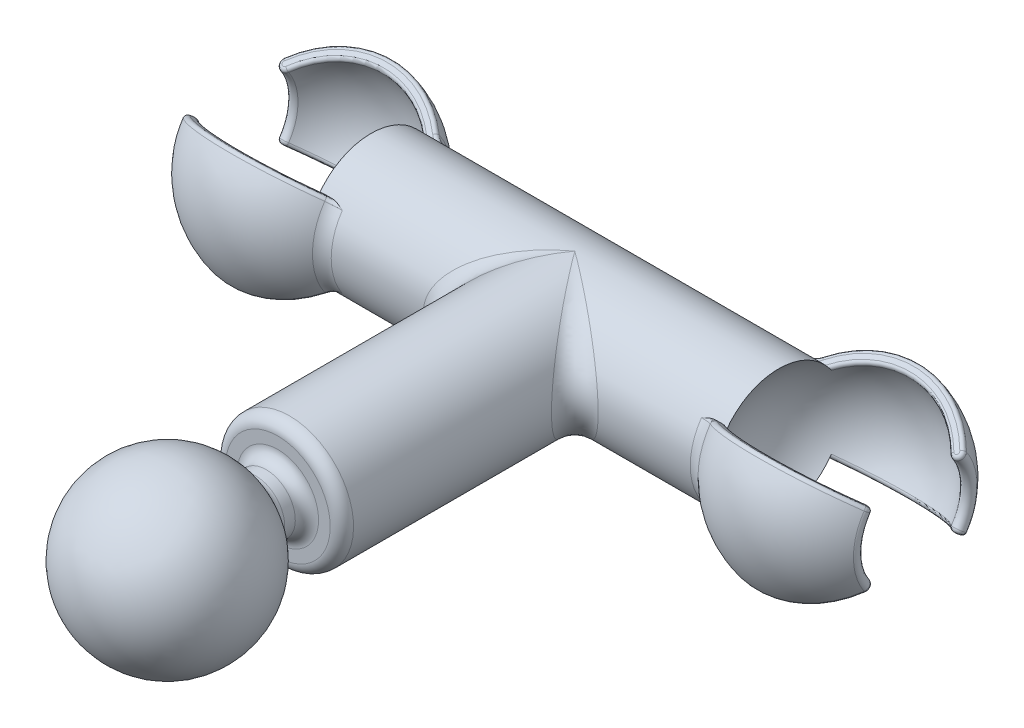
SolidWorks part; units mm, degrees
ref_plane "Front Plane" through (0, 0, 0) normal (0, 0, 1) x (1, 0, 0)
ref_plane "Top Plane" through (0, 0, 0) normal (0, 1, 0) x (1, 0, 0)
ref_plane "Right Plane" through (0, 0, 0) normal (1, 0, 0) x (0, 0, -1)
sketch "Sketch1" plane through (0, 0, 0) normal (0, 0, 1) x (1, 0, 0)
  line L0 (0, 6.985) -> (0, 0)
  line L2 (0, 6.985) -> (22.225, 6.985)
  line L3 (28.7008, 0) -> (-15.6104, 0) construction
  line L4 (0, 0) -> (19.1758, 0)
  line L5 (0, 0) -> (0, 8.7802) construction
  arc A1 (22.225, 6.985) -> (19.1758, 0) centre (28.7008, 0) ccw
  dimension "D1" = 22.225
  dimension "D2" = 9.525
  dimension "D5" = 6.985
revolve "Revolve1" add sketch "Sketch1" angle 360 about L3
sketch "Sketch2" plane through (0, 0, 0) normal (0, 1, 0) x (1, 0, 0)
  line L0 (0, 0) -> (75.9783, 0) construction
  line L2 (0, -6.985) -> (22.225, -6.985) construction
  line L3 (20.4702, -6.985) -> (22.225, -6.985)
  arc A0 (22.225, -6.985) -> (36.1362, -5.9531) centre (28.7008, 0) ccw
  arc A1 (20.4702, -6.985) -> (37.1276, -6.7469) centre (28.7008, 0) ccw
  arc A2 (36.1362, -5.9531) -> (37.1276, -6.7469) centre (36.6319, -6.35) cw
  arc A3 (22.225, 6.985) -> (22.225, -6.985) centre (28.7008, 0) ccw construction
  dimension "D1" = 10.795
  dimension "D3" = 6.35
revolve "Revolve2" add sketch "Sketch2" angle 75 mid plane about L0
mirror "Mirror1" about plane through (0, 0, 0) normal (0, 0, 1) of "Revolve2"
fillet "Fillet2" radius 2.032 2 edges at (20.4702, 0, 6.985) (20.4702, 0, -6.985)
fillet "Fillet3" radius 0.381 16 edges at (37.0288, 3.5639, 4.6445) (20.361, -4.3477, -5.6661) (29.2642, -6.5626, -8.5526) (37.0288, -3.5639, -4.6445) (29.4053, -5.7826, -7.536) (37.0288, -3.5639, 4.6445) (29.4053, -5.7826, 7.536) (20.361, -4.3477, 5.6661) (29.2642, -6.5626, 8.5526) (20.361, 4.3477, 5.6661) (20.361, 4.3477, -5.6661) (37.0288, 3.5639, -4.6445) (29.2642, 6.5626, -8.5526) (29.4053, 5.7826, -7.536) (29.4053, 5.7826, 7.536) (29.2642, 6.5626, 8.5526)
mirror "Mirror2" about plane through (0, 0, 0) normal (1, 0, 0) of "Revolve1", "Revolve2", "Mirror1", "Fillet2", "Fillet3"
sketch "Sketch3" plane through (0, 0, 0) normal (1, 0, 0) x (0, 0, -1)
  line L0 (0, 0) -> (-53.7972, 0)
  line L1 (0, 0) -> (0, 6.985)
  line L2 (0, 6.985) -> (-31.115, 6.985)
  line L3 (-32.385, 5.715) -> (-32.385, 4.445)
  line L4 (-33.655, 3.175) -> (-34.8081, 3.175)
  line L5 (0, 0) -> (-71.7758, 0) construction
  arc A0 (-35.9614, 3.9133) -> (-53.7972, 0) centre (-44.45, 0) ccw
  arc A1 (-31.115, 6.985) -> (-32.385, 5.715) centre (-31.115, 5.715) ccw
  arc A2 (-32.385, 4.445) -> (-33.655, 3.175) centre (-33.655, 4.445) cw
  arc A3 (-34.8081, 3.175) -> (-35.9614, 3.9133) centre (-34.8081, 4.445) cw
  dimension "D5" = 9.3472
  dimension "D6" = 1.27
  dimension "D1" = 44.45
  dimension "D2" = 12.065
  dimension "D3" = 3.175
  dimension "D4" = 6.985
revolve "Revolve3" add sketch "Sketch3" angle 360 about L5
fillet "Fillet4" radius 2.54 2 edges at (-6.985, 0, 6.985) (6.985, 0, 6.985)
